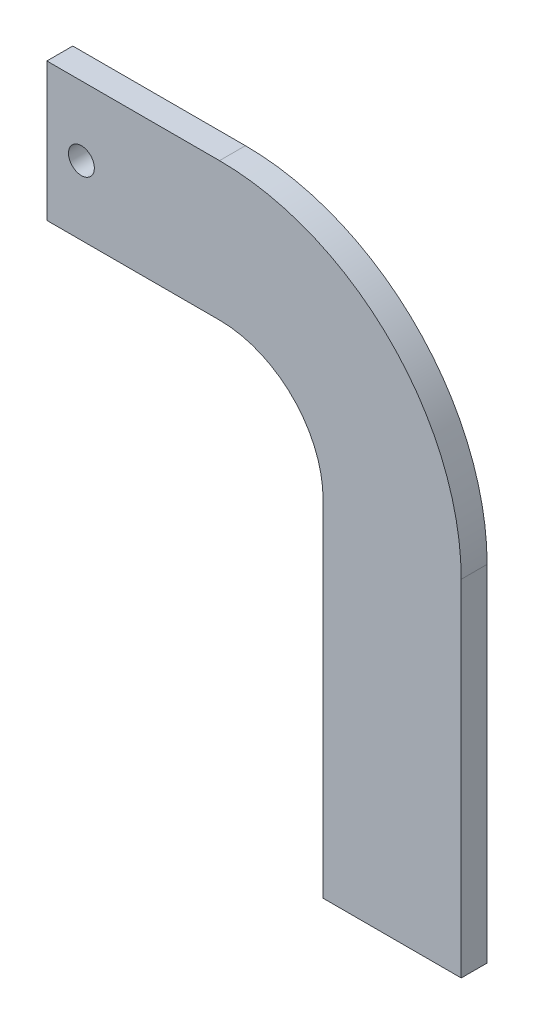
SolidWorks part; units mm, degrees
ref_plane "Front Plane" through (0, 0, 0) normal (0, 0, 1) x (1, 0, 0)
ref_plane "Top Plane" through (0, 0, 0) normal (0, 1, 0) x (1, 0, 0)
ref_plane "Right Plane" through (0, 0, 0) normal (1, 0, 0) x (0, 0, -1)
sketch "Sketch3" plane through (0, 0, 0) normal (0, 0, 1) x (1, 0, 0)
  line L0 (0, 0) -> (101.6, 0)
  line L1 (101.6, 0) -> (101.6, 254)
  line L2 (0, 0) -> (0, 254)
  line L3 (-76.2, 330.2) -> (-203.2, 330.2)
  line L4 (-203.2, 330.2) -> (-203.2, 431.8)
  line L5 (-203.2, 431.8) -> (-76.2, 431.8)
  arc A0 (0, 254) -> (-76.2, 330.2) centre (-76.2, 254) ccw
  arc A1 (101.6, 254) -> (-76.2, 431.8) centre (-76.2, 254) ccw
  circle A2 centre (-177.8, 381) radius 9.525
  dimension "D3" = 127
  dimension "D4" = 330.2
  dimension "D7" = 19.05
  dimension "D6" = 101.6
  dimension "D8" = 50.8
  dimension "D1" = 101.6
  dimension "D2" = 254
  dimension "D5" = 254
  dimension "D9" = 25.4
extrude "Extrude1" add sketch "Sketch3" along normal blind 19.05
